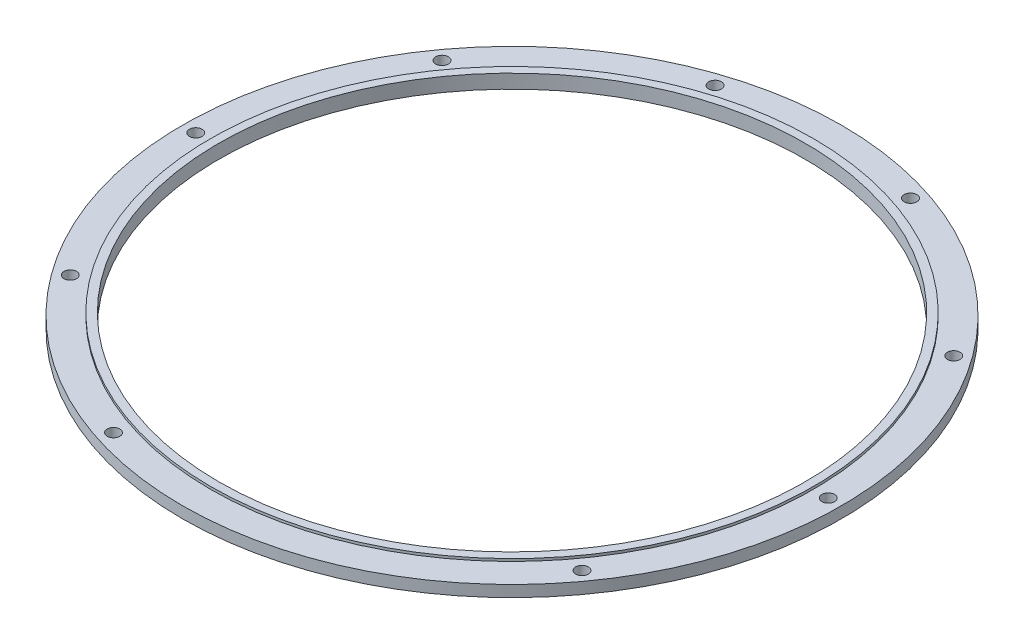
SolidWorks part; units mm, degrees
ref_plane "Front" through (0, 0, 0) normal (0, 0, 1) x (1, 0, 0)
ref_plane "Top" through (0, 0, 0) normal (0, 1, 0) x (1, 0, 0)
ref_plane "Right" through (0, 0, 0) normal (1, 0, 0) x (0, 0, -1)
sketch "Sketch1" plane through (0, 0, 0) normal (0, 0, 1) x (1, 0, 0)
  line L1 (84.858, 0) -> (84.858, -19.701)
  line L2 (84.858, -19.701) -> (75.5, -19.701)
  line L3 (75.5, -19.701) -> (75.5, -16.272)
  line L4 (75.5, -16.272) -> (78, -16.272)
  line L5 (78, -16.272) -> (78, -8.272)
  line L6 (78, -8.272) -> (75.5, -8.272)
  line L7 (75.5, -8.272) -> (75.5, 0)
  line L8 (75.5, 0) -> (84.858, 0)
  line L9 (0, 0) -> (0, -17.7605) construction
  dimension "D1" = 156
  dimension "D2" = 151
  dimension "D3" = 8
  dimension "D4" = 8.272
  dimension "D5" = 3.429
  dimension "D6" = 6.858
revolve "Revolve1" add sketch "Sketch1" angle 360 about L9
ref_plane "Plane1" through (0, -16.772, 0) normal (0, -1, 0) x (1, 0, 0)
hole_wizard "#30 (0.1285) Diameter Hole1" positions "Sketch4" profile "Sketch3" hole size "#30" standard "Ansi Inch"
sketch "Sketch4" plane through (0, -19.701, 0) normal (0, -1, 0) x (1, 0, 0)
  circle A9 centre (-25.1629, -77.4436) radius 1.6319 construction
  point P9 (-25.1629, -77.4436)
sketch "Sketch3" plane through (-25.1629, -19.701, -77.4436) normal (1, 0, 0) x (0, 0, -1)
  line L0 (0, 0) -> (0, 19.701)
  line L1 (0, 19.701) -> (1.6319, 19.701)
  line L2 (1.6319, 19.701) -> (1.6319, 0)
  line L5 (1.6319, 0) -> (0, 0)
  line L11 (0, -6.35) -> (0, 107.95) construction
  dimension "Thru Hole Dia." = 3.2639
  dimension "Thru Hole Depth" = 19.701
pattern_circular "CirPattern1" count 10 over 360 about axis through (0, 0, 0) along (0, 1, 0) of "#30 (0.1285) Diameter Hole1"
sketch "Sketch5" plane through (0, 0, 0) normal (0, 0, 1) x (1, 0, 0)
  line L0 (77.6, -16.272) -> (77.6, -16.772)
  line L2 (-55, -16.772) -> (55, -16.772) construction
  line L3 (77.6, -16.772) -> (84.8659, -16.772)
  line L4 (84.8659, -16.772) -> (84.8659, 0)
  line L6 (84.8659, 0) -> (75.5, 0)
  line L8 (75.5, 0) -> (75.5, -16.272)
  line L9 (75.5, -16.272) -> (-75.5, -16.272) construction
  line L10 (75.5, -16.272) -> (77.6, -16.272)
  line L11 (78, -16.272) -> (-78, -16.272) construction
  line L13 (75.5, -19.701) -> (75.5, -16.272) construction
  line L14 (0, 0) -> (0, -22.6099) construction
  line L15 (78, -16.272) -> (78, -8.272) construction
  dimension "D1" = 0.4
revolve "Cut-Revolve1" cut sketch "Sketch5" angle 360 about L14
sketch "Sketch6" plane through (0, -16.272, 0) normal (0, 1, 0) x (-1, 0, 0)
  circle A0 centre (0, 0) radius 77.6
  circle A1 centre (0, 0) radius 75.5
  circle A2 centre (0, 0) radius 75.5 construction
  circle A3 centre (0, 0) radius 77.6 construction
extrude "Extrude1" add sketch "Sketch6" along normal blind 0.15
